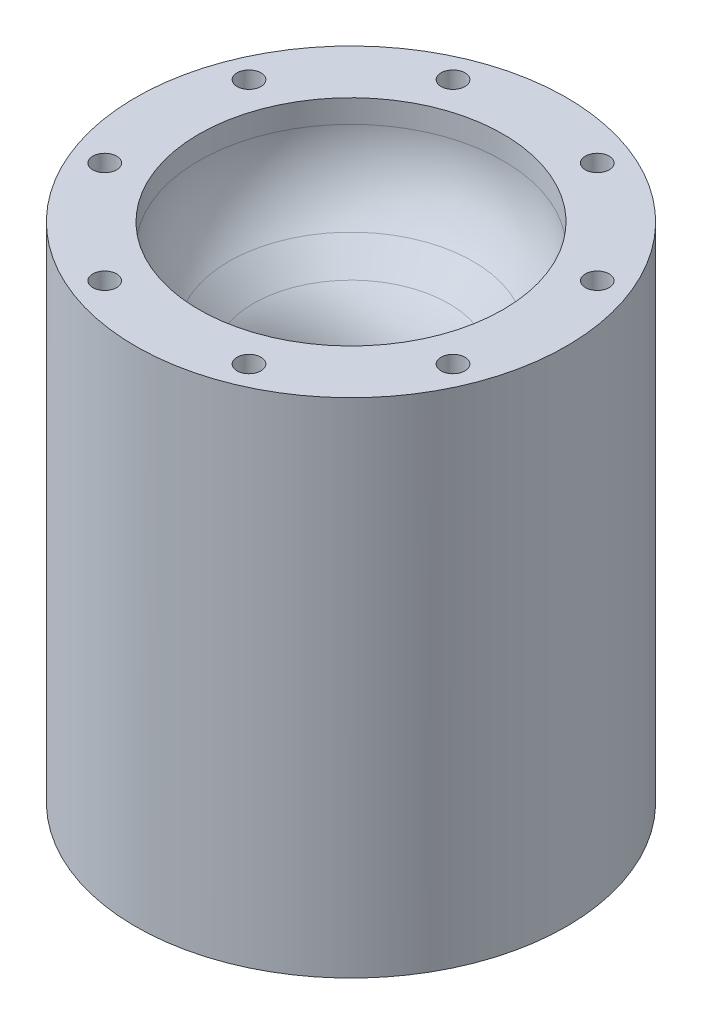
SolidWorks part; units mm, degrees
ref_plane "Front Plane" through (0, 0, 0) normal (0, 0, 1) x (1, 0, 0)
ref_plane "Top Plane" through (0, 0, 0) normal (0, 1, 0) x (1, 0, 0)
ref_plane "Right Plane" through (0, 0, 0) normal (1, 0, 0) x (0, 0, -1)
body saved out of another part "Stock-SolidRocketV6-1"
move or copy body "Body-Move/Copy1" bodies to move or copy 101 placed by mates yes
hole_wizard "3/8-24 Tapped Hole1" positions "Sketch1" profile "Sketch2" tap size "3/8-24" standard "ANSI Inch"
sketch "Sketch1" plane through (0, 0, 0) normal (0, 1, 0) x (1, 0, 0)
  line L0 (61.5997, -25.5154) -> (0, 0) construction
  line L1 (0, 0) -> (66.675, 0) construction
  circle A0 centre (0, 0) radius 66.675 construction
  point P14 (61.5997, -25.5154)
  dimension "D1" = 133.35
  dimension "D2" = 22.5
sketch "Sketch2" plane through (61.5997, 0, 25.5154) normal (1, 0, 0) x (0, 0, 1)
  line L0 (0, 0) -> (0, 24.761)
  line L1 (0, 24.761) -> (4.2164, 22.2275)
  line L2 (4.2164, 22.2275) -> (4.2164, 0)
  line L5 (4.2164, 0) -> (0, 0)
  line L10 (0, 24.761) -> (-4.2164, 22.2275) construction
  line L11 (0, -6.35) -> (0, 107.95) construction
  dimension "Tap Drill Dia." = 8.4328
  dimension "Tap Drill Depth" = 22.2275
  dimension "Drill Angle" = 118
pattern_circular "CirPattern1" count 8 over 360 about axis through (0, 0, 0) along (0, 1, 0) of "3/8-24 Tapped Hole1"
